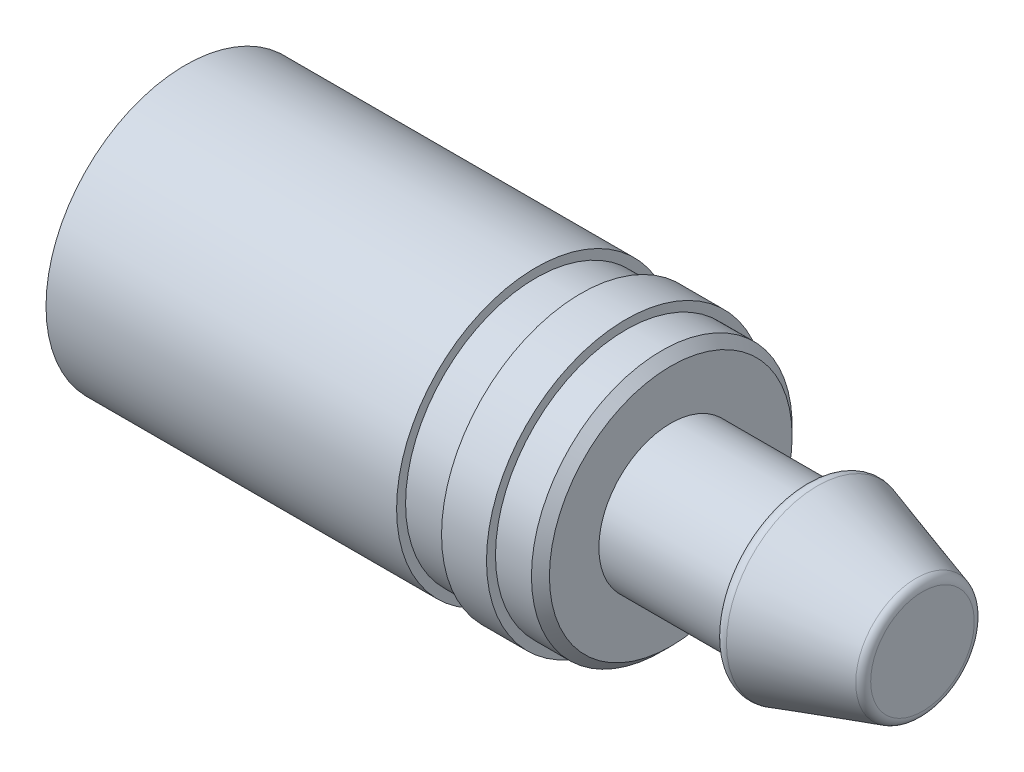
SolidWorks part; units mm, degrees
ref_plane "Alzado" through (0, 0, 0) normal (0, 0, 1) x (1, 0, 0)
ref_plane "Planta" through (0, 0, 0) normal (0, 1, 0) x (1, 0, 0)
ref_plane "Vista lateral" through (0, 0, 0) normal (1, 0, 0) x (0, 0, -1)
sketch "Croquis1" plane through (0, 0, 0) normal (0, 0, 1) x (1, 0, 0)
  line L0 (0, 0) -> (36.1529, 0) construction
  line L1 (0, 0) -> (0, 15.5)
  line L2 (0, 15.5) -> (39, 15.5)
  line L3 (39, 15.5) -> (39, 14.5)
  line L4 (39, 14.5) -> (44, 14.5)
  line L5 (44, 14.5) -> (44, 15.5)
  line L6 (44, 15.5) -> (49, 15.5)
  line L7 (49, 15.5) -> (49, 14.5)
  line L8 (49, 14.5) -> (54, 14.5)
  line L9 (54, 14.5) -> (54, 8)
  line L10 (54, 8) -> (69, 8)
  line L11 (69, 8) -> (69, 10.5)
  line L12 (69, 10.5) -> (82, 6.5)
  line L15 (0, 0) -> (82, 0)
  line L16 (82, 0) -> (82, 6.5)
  dimension "D1" = 31
  dimension "D2" = 39
  dimension "D3" = 1
  dimension "D4" = 5
  dimension "D5" = 5
  dimension "D6" = 5
  dimension "D7" = 16
  dimension "D8" = 15
  dimension "D9" = 13
  dimension "D10" = 28
  dimension "D11" = 21
revolve "Revolución1" add sketch "Croquis1" angle 360 about L0
fillet "Redondeo1" radius 1 2 edges at (82, 0, 6.5) (69, 0, 10.5)
chamfer "Chaflán1" distance 1 angle 45 1 edges at (54, 0, 14.5)
